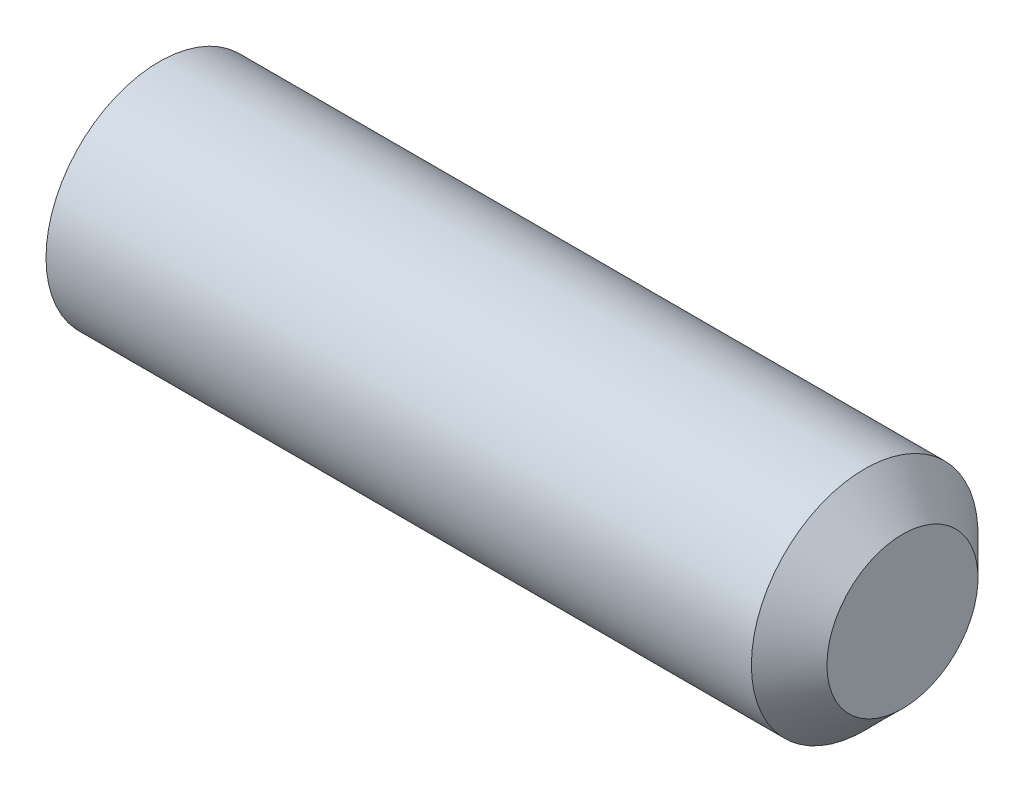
SolidWorks part; units mm, degrees
ref_plane "Plane1" through (0, 0, 0) normal (0, 0, 1) x (1, 0, 0)
ref_plane "Plane2" through (0, 0, 0) normal (0, 1, 0) x (1, 0, 0)
ref_plane "Plane3" through (0, 0, 0) normal (1, 0, 0) x (0, 0, -1)
other "PropertyManager"
sketch "BodySke" plane through (0, 0, 0) normal (0, 0, 1) x (1, 0, 0)
  line L0 (0, 0) -> (0, 1.2195)
  line L1 (0, 1.2195) -> (0.1619, 1.5)
  line L2 (0.1619, 1.5) -> (9.5, 1.5)
  line L3 (9.5, 1.5) -> (10, 1)
  line L4 (10, 0) -> (0, 0)
  line L5 (-12.7, 0) -> (88.9, 0) construction
  line L6 (10, 1) -> (10, 0)
  line L7 (10, 1) -> (10, 10.525) construction
  line L8 (0, -1.2195) -> (0.1619, -1.5) construction
  line L9 (0.5, 15.875) -> (0.5, -3.175) construction
  line L10 (9.5, -1.5) -> (10, -1) construction
  dimension "Length" = 10
  dimension "Diameter" = 3
  dimension "Drive_ch_ang" = 60
  dimension "Minor_dia" = 2.439
  dimension "Cup_nose_ang" = 45
  dimension "Cup_dia" = 2
  dimension "Advance" = 0.5
revolve "BaseBody" add sketch "BodySke" angle 360 about L5
sketch "Sketch2" plane through (0, 0, 0) normal (-1, 0, 0) x (0, 0, 1)
  line L0 (0.433, 0.75) -> (-0.433, 0.75)
  line L1 (-0.433, 0.75) -> (-0.866, 0)
  line L2 (0.433, 0.75) -> (0.866, 0)
  line L3 (0.433, -0.75) -> (0.866, 0)
  line L4 (0.433, -0.75) -> (-0.433, -0.75)
  line L5 (-0.433, -0.75) -> (-0.866, 0)
  dimension "Hex_size" = 1.5
  dimension "D2" = 0.75
  dimension "D3" = 0.75
extrude "Hex" cut sketch "Sketch2" against normal blind 1.2
equation "\"D2@Sketch2\" = \"Hex_size@Sketch2\" / 2"
equation "\"D3@Sketch2\" = \"Hex_size@Sketch2\" / 2"
equation "' \"Num_threads@ThdSchPat\" = \"Num_threads@ThdSchPat\" - sgn( \"Num_threads@ThdSchPat\" - 1) '---chamfered tips only---"
